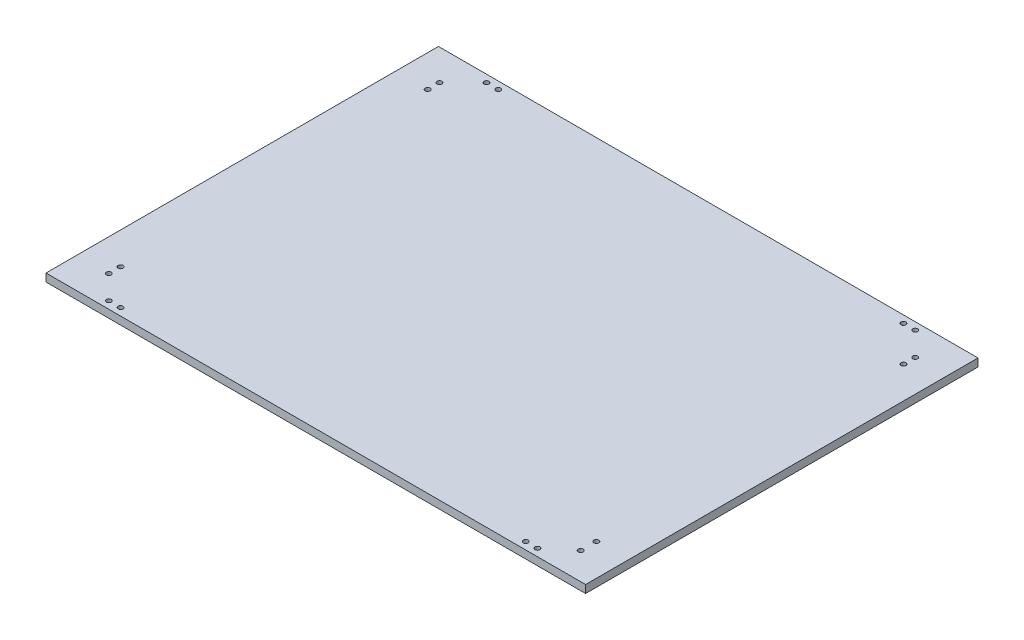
SolidWorks part; units mm, degrees
ref_plane "Face" through (0, 0, 0) normal (0, 0, 1) x (1, 0, 0)
ref_plane "Dessus" through (0, 0, 0) normal (0, 1, 0) x (1, 0, 0)
ref_plane "Droite" through (0, 0, 0) normal (1, 0, 0) x (0, 0, -1)
sketch "Esquisse1" plane through (0, 0, 0) normal (0, 1, 0) x (1, 0, 0)
  line L1 (0, 0) -> (1100, 0)
  line L2 (0, 0) -> (0, 800)
  line L3 (0, 800) -> (1100, 800)
  line L4 (1100, 0) -> (1100, 800)
  dimension "D1" = 1100
  dimension "D2" = 800
extrude "Extrusion1" add sketch "Esquisse1" along normal blind 16
sketch "Esquisse2" plane through (0, 16, 0) normal (0, 1, 0) x (-1, 0, 0)
  line L0 (0, -800) -> (0, 0) construction
  line L1 (-1100, -800) -> (0, -800) construction
  line L2 (-33.9619, -400) -> (-1226.176, -400) construction
  line L3 (-125, 60.6746) -> (-125, -961.6816) construction
  line L4 (-975, 60.6746) -> (-975, -961.6816) construction
  line L5 (-550, -851.3316) -> (-550, -76.798) construction
  line L7 (-1149.9755, -725) -> (114.1671, -725) construction
  line L8 (-1149.9755, -75) -> (114.1671, -75) construction
  circle A0 centre (-113, -785) radius 5
  circle A1 centre (-65, -713) radius 5
  circle A2 centre (-1035, -87) radius 5
  circle A3 centre (-65, -63) radius 5
  circle A4 centre (-1035, -55) radius 5
  circle A5 centre (-1035, -737) radius 5
  circle A6 centre (-1035, -713) radius 5
  circle A7 centre (-137, -785) radius 5
  circle A8 centre (-65, -737) radius 5
  circle A10 centre (-137, -15) radius 5
  circle A12 centre (-113, -15) radius 5
  circle A13 centre (-987, -15) radius 5
  circle A14 centre (-963, -15) radius 5
  circle A15 centre (-963, -785) radius 5
  circle A16 centre (-65, -87) radius 5
  circle A17 centre (-987, -785) radius 5
  dimension "D1" = 10
  dimension "D6" = 10
  dimension "D2" = 12
  dimension "D3" = 15
  dimension "D4" = 400
  dimension "D5" = 550
  dimension "D7" = 65
  dimension "D8" = 12
  dimension "D9" = 125
  dimension "D10" = 75
extrude "Enlèv. mat.-Extru.1" cut sketch "Esquisse2" against normal through all
